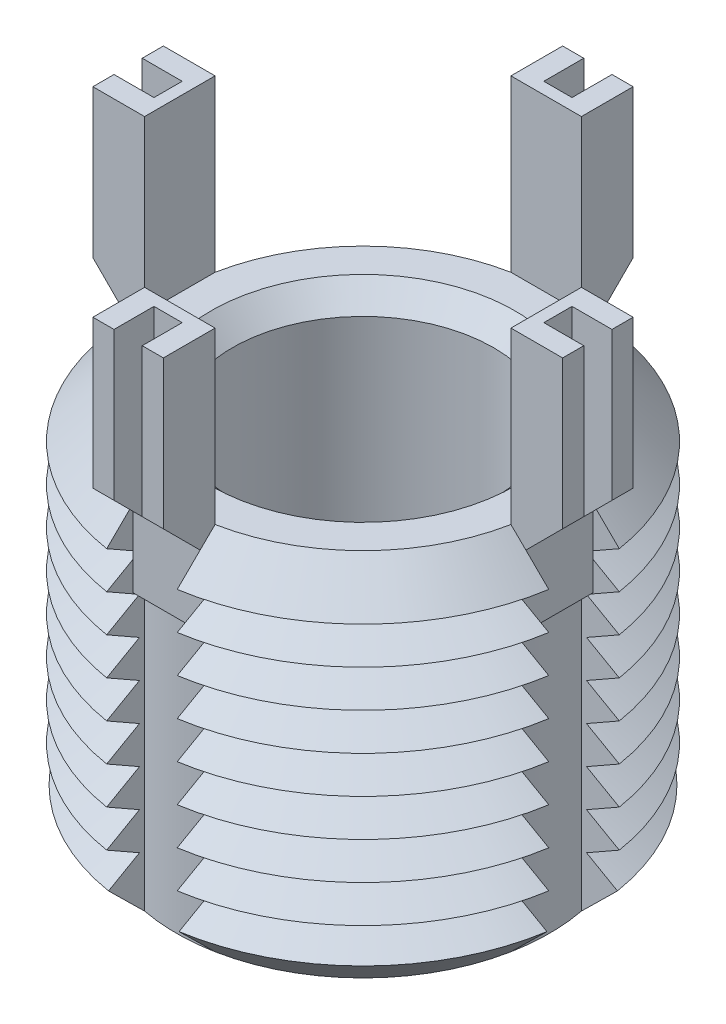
SolidWorks part; units mm, degrees
ref_plane "Front Plane" through (0, 0, 0) normal (0, 0, 1) x (1, 0, 0)
ref_plane "Top Plane" through (0, 0, 0) normal (0, 1, 0) x (1, 0, 0)
ref_plane "Right Plane" through (0, 0, 0) normal (1, 0, 0) x (0, 0, -1)
sketch "Sketch1" plane through (0, 0, 0) normal (0, 1, 0) x (1, 0, 0)
  circle A0 centre (0, 0) radius 9.525
  dimension "D1" = 19.05
extrude "Boss-Extrude1" add sketch "Sketch1" against normal blind 15.748
chamfer "Chamfer1" distance 1.587 angle 45 2 edges at (0, -15.748, 9.525) (0, 0, 9.525)
sketch "Sketch2" plane through (0, 0, 0) normal (1, 0, 0) x (0, 0, -1)
  line L0 (0, 0.8859) -> (0, -9.2617) construction
sketch "Sketch3" plane through (0, 0, 0) normal (1, 0, 0) x (0, 0, -1)
  line L0 (-9.525, -1.587) -> (-8.1506, -2.3805)
  line L1 (-8.1506, -2.3805) -> (-9.525, -3.174)
  line L2 (-9.525, -1.587) -> (-9.525, -14.161) construction
  line L3 (-9.525, -3.174) -> (-9.525, -1.587)
  dimension "D1" = 1.587
revolve "Cut-Revolve1" cut sketch "Sketch3" angle 360 about L0
pattern_linear "LPattern1" count 8 spacing 1.587 along (0, -1, 0) of "Cut-Revolve1"
sketch "Sketch4" plane through (0, 0, 0) normal (0, 1, 0) x (1, 0, 0)
  line L0 (-7.795, 1.5) -> (-9.4061, 1.5)
  line L2 (-9.4061, -1.5) -> (-7.795, -1.5)
  arc A0 (-7.795, 1.5) -> (-7.795, -1.5) centre (0, 0) ccw
  arc A1 (-9.4061, 1.5) -> (-9.4061, -1.5) centre (0, 0) ccw
  circle A2 centre (0, 0) radius 9.525 construction
  circle A3 centre (0, 0) radius 7.938 construction
  point P1 (-7.938, 0)
  point P3 (-9.525, 0)
  point P13 (0, 0)
  dimension "D1" = 3
extrude "Cut-Extrude1" cut sketch "Sketch4" against normal up to surface (15.748 mm away)
pattern_circular "CirPattern1" count 4 over 360 about axis through (0, 0, 0) along (0, 1, 0) of "Cut-Extrude1"
sketch "Sketch5" plane through (0, 0, 0) normal (1, 0, 0) x (0, 0, -1)
  line L0 (-7.795, 7.239) -> (-7.795, -3.761)
  line L1 (-7.795, -3.761) -> (-8.295, -3.761)
  line L2 (-8.295, -3.761) -> (-8.295, -0.761)
  line L3 (-8.295, -0.761) -> (-9.995, 0.939)
  line L4 (-9.995, 0.939) -> (-9.995, 7.239)
  line L5 (-9.995, 7.239) -> (-7.795, 7.239)
  line L6 (-9.4061, -4.761) -> (-1.5, -4.761) construction
  point P9 (-1.5, 0)
  point P10 (-8.295, -0.761)
  dimension "D1" = 1
  dimension "D2" = 11
  dimension "D3" = 8
  dimension "D4" = 2.2
  dimension "D5" = 0.5
  dimension "D6" = 45
extrude "Boss-Extrude3" add sketch "Sketch5" along normal mid plane 3
pattern_circular "CirPattern2" count 4 over 360 about axis through (0, 0, 0) along (0, 1, 0) of "Boss-Extrude3"
sketch "Sketch6" plane through (0, 7.239, 0) normal (0, 1, 0) x (1, 0, 0)
  line L0 (-9.995, -1.5) -> (-9.995, 1.5) construction
  line L1 (-9.995, -0.6) -> (-8.295, -0.6)
  line L2 (-9.995, -0.6) -> (-9.995, 0.6)
  line L3 (-9.995, 0.6) -> (-8.295, 0.6)
  line L4 (-8.295, -0.6) -> (-8.295, 0.6)
  line L5 (-9.995, -0.6) -> (-8.295, 0.6) construction
  line L6 (-9.995, 0.6) -> (-8.295, -0.6) construction
  line L7 (9.995, 1.5) -> (9.995, -1.5) construction
  line L8 (-0.6, 8.295) -> (0.6, 8.295)
  line L9 (-0.6, 8.295) -> (-0.6, 9.995)
  line L10 (-0.6, 9.995) -> (0.6, 9.995)
  line L11 (0.6, 8.295) -> (0.6, 9.995)
  line L12 (-0.6, 8.295) -> (0.6, 9.995) construction
  line L13 (-0.6, 9.995) -> (0.6, 8.295) construction
  line L14 (8.295, -0.6) -> (9.995, -0.6)
  line L15 (8.295, -0.6) -> (8.295, 0.6)
  line L16 (8.295, 0.6) -> (9.995, 0.6)
  line L17 (9.995, -0.6) -> (9.995, 0.6)
  line L18 (8.295, -0.6) -> (9.995, 0.6) construction
  line L19 (8.295, 0.6) -> (9.995, -0.6) construction
  line L20 (-0.6, -9.995) -> (0.6, -9.995)
  line L21 (-0.6, -9.995) -> (-0.6, -8.295)
  line L22 (-0.6, -8.295) -> (0.6, -8.295)
  line L23 (0.6, -9.995) -> (0.6, -8.295)
  line L24 (-0.6, -9.995) -> (0.6, -8.295) construction
  line L25 (-0.6, -8.295) -> (0.6, -9.995) construction
  line L26 (-1.5, 9.995) -> (1.5, 9.995) construction
  line L27 (1.5, -9.995) -> (-1.5, -9.995) construction
  point P0 (-9.145, 0)
  point P7 (-9.995, 0)
  point P8 (-9.995, 0)
  point P9 (0, 9.145)
  point P14 (9.145, 0)
  point P19 (0, -9.145)
  point P24 (0, 9.995)
  point P25 (9.995, 0)
  point P26 (9.995, 0)
  point P27 (0, 9.995)
  point P30 (0, -9.995)
  point P33 (0, -9.995)
  dimension "D1" = 1.2
  dimension "D2" = 1.7
extrude "Cut-Extrude3" cut sketch "Sketch6" against normal through all both and the other way through all
sketch "Sketch7" plane through (0, 0, 0) normal (0, 1, 0) x (1, 0, 0)
  circle A0 centre (0, 0) radius 5.556
  dimension "D1" = 11.112
extrude "Cut-Extrude4" cut sketch "Sketch7" against normal up to surface (15.748 mm away)
chamfer "Chamfer2" distance 0.907 angle 45 2 edges at (0, 0, 5.556) (0, -15.748, 5.556)
